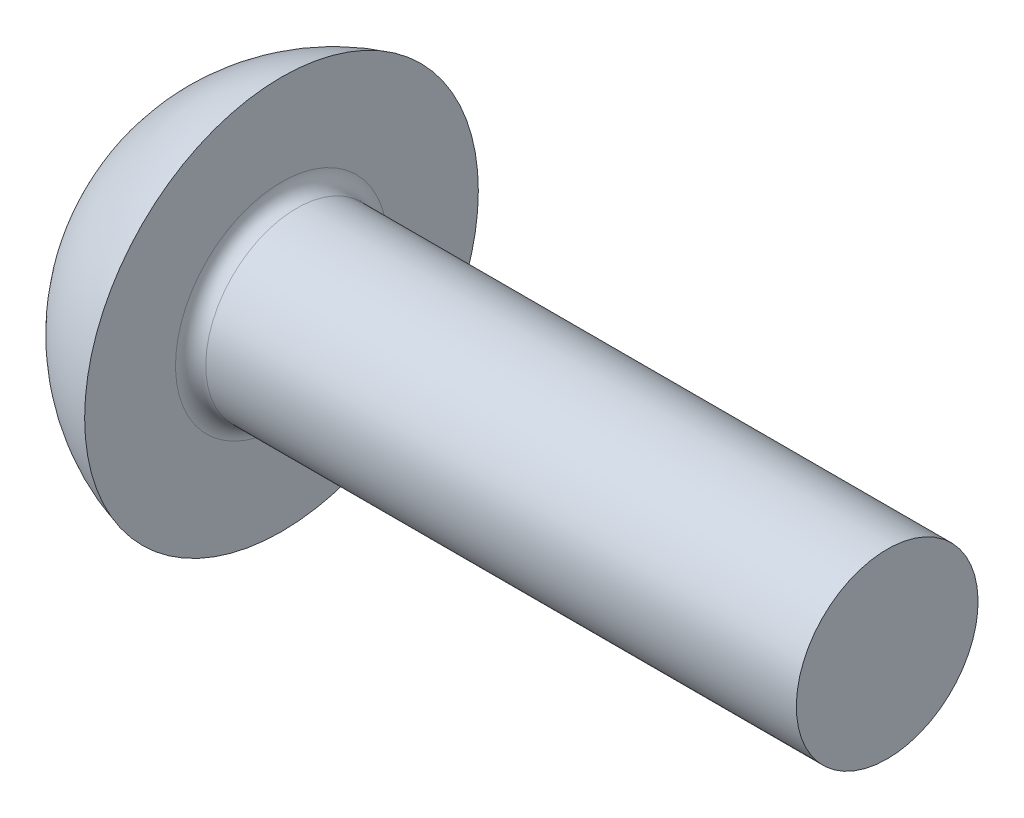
SolidWorks part; units mm, degrees
ref_plane "Front" through (0, 0, 0) normal (0, 0, 1) x (1, 0, 0)
ref_plane "Top" through (0, 0, 0) normal (0, 1, 0) x (1, 0, 0)
ref_plane "Right" through (0, 0, 0) normal (1, 0, 0) x (0, 0, -1)
other "Configuration Table"
sketch "Sketch1" plane through (3.1034, 2.4534, 0) normal (0, 0, 1) x (0, 1, 0)
  line L0 (-2.4534, 0.6034) -> (-2.4534, 3.1034)
  line L1 (-1.8034, 2.6034) -> (-2.1534, 2.6034)
  line L2 (-2.1534, 2.6034) -> (-2.1534, 0.6034)
  line L3 (-2.4534, 0.6034) -> (-2.1534, 0.6034)
  line L4 (-2.4534, 7.0931) -> (-2.4534, -0.3296) construction
  arc A0 (-2.4534, 3.1034) -> (-1.8034, 2.6034) centre (-2.4534, 2.4309) cw
  dimension "l" = 2
  dimension "K" = 0.5
  dimension "d" = 0.6
  dimension "dk" = 1.3
revolve "Base-Revolve" add sketch "Sketch1" angle 360 about L4
fillet "Fillet1" radius 0.05 1 edges at (0.5, -0.3, 0)
